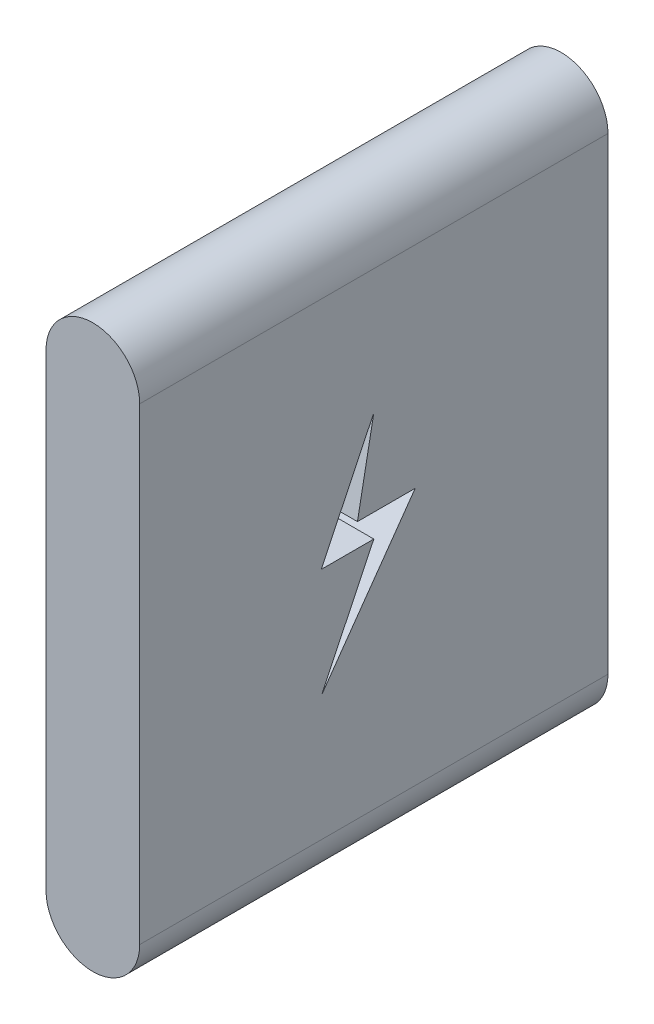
SolidWorks part; units mm, degrees
ref_plane "Front Plane" through (0, 0, 0) normal (0, 0, 1) x (1, 0, 0)
ref_plane "Top Plane" through (0, 0, 0) normal (0, 1, 0) x (1, 0, 0)
ref_plane "Right Plane" through (0, 0, 0) normal (1, 0, 0) x (0, 0, -1)
sketch "Sketch1" plane through (0, 0, 0) normal (0, 0, 1) x (1, 0, 0)
  line L0 (0, -50) -> (0, 50) construction
  line L1 (-10, -50) -> (-10, 50)
  line L2 (10, -50) -> (10, 50)
  arc A0 (-10, -50) -> (10, -50) centre (0, -50) ccw
  arc A1 (10, 50) -> (-10, 50) centre (0, 50) ccw
  point P2 (0, 0)
  dimension "D2" = 10
  dimension "D1" = 100
extrude "Boss-Extrude1" add sketch "Sketch1" along normal blind 100
sketch "Sketch2" plane through (10, 0, 0) normal (1, 0, 0) x (0, 0, -1)
  line L0 (-50, -50) -> (-50, -31.665) construction
  line L1 (-50, 23.3806) -> (-53.4979, 4.9707)
  line L2 (-50, 23.3806) -> (-61.23, 0)
  line L3 (-70.8032, 23.3806) -> (-29.1968, 23.3806)
  line L4 (-70.8032, 23.3806) -> (-70.8032, -23.3806)
  line L5 (-70.8032, -23.3806) -> (-29.1968, -23.3806)
  line L6 (-29.1968, 23.3806) -> (-29.1968, -23.3806)
  line L8 (-53.4979, 4.9707) -> (-41.1633, 4.9707)
  line L9 (-61.23, 0) -> (-50, 0)
  line L10 (-50, 0) -> (-61.23, -23.3806)
  line L11 (-61.23, -23.3806) -> (-50, -9.7661)
  line L14 (-41.1633, 4.9707) -> (-61.23, -23.3806)
  point P1 (-50, 0)
extrude "Cut-Extrude1" cut sketch "Sketch2" against normal through all both and the other way through all contours L9 L0 L8 L1 L2 | L0 L14 L8 | L14 L0 L10
